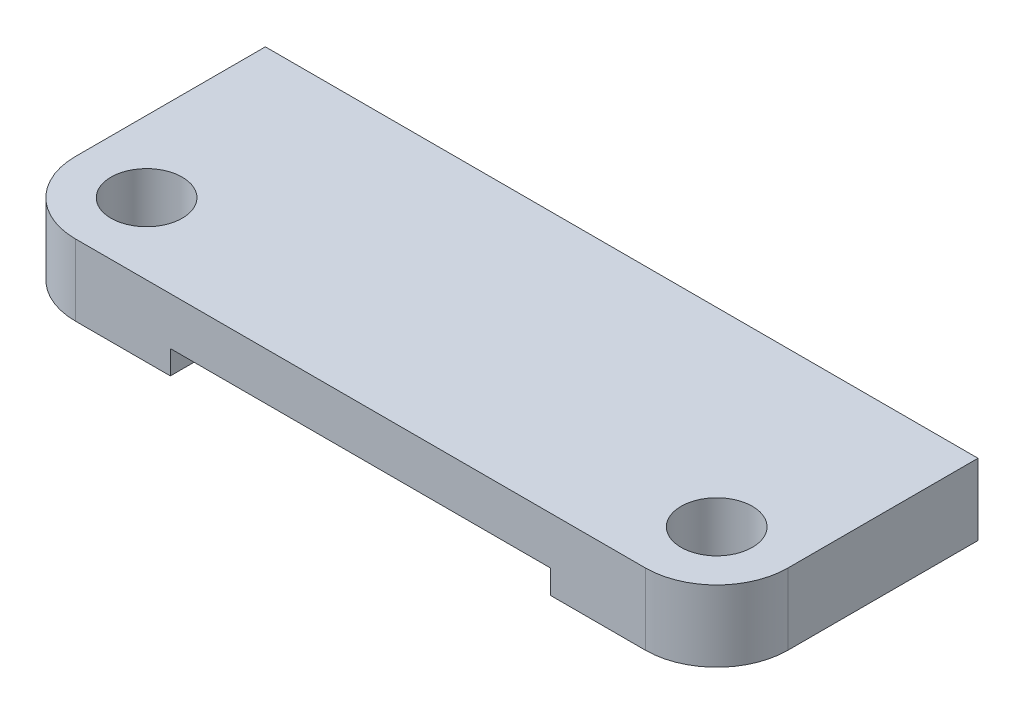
SolidWorks part; units mm, degrees
ref_plane "前视基准面" through (0, 0, 0) normal (0, 0, 1) x (1, 0, 0)
ref_plane "上视基准面" through (0, 0, 0) normal (0, 1, 0) x (1, 0, 0)
ref_plane "右视基准面" through (0, 0, 0) normal (1, 0, 0) x (0, 0, -1)
sketch "草图1" plane through (0, 0, 0) normal (0, 1, 0) x (1, 0, 0)
  line L0 (30, 0) -> (-30, 0)
  line L1 (-30, 0) -> (-30, -16)
  line L2 (-24, -22) -> (24, -22)
  line L3 (0, 24.4123) -> (0, -40.1298) construction
  line L4 (-24, -8.8168) -> (-24, -27.5731) construction
  line L5 (-35.1279, -16) -> (-17.5773, -16) construction
  line L6 (30, 0) -> (30, -16)
  circle A0 centre (-24, -16) radius 3
  arc A1 (-30, -16) -> (-24, -22) centre (-24, -16) ccw
  circle A2 centre (24, -16) radius 3
  arc A3 (30, -16) -> (24, -22) centre (24, -16) cw
  point P15 (-30, -22)
  point P20 (0, -22)
  point P21 (0, 0)
  dimension "D3" = 6
  dimension "D4" = 6
  dimension "D1" = 30
  dimension "D2" = 22
extrude "凸台-拉伸1" add sketch "草图1" along normal blind 6
sketch "草图2" plane through (0, 0, 22) normal (0, 0, 1) x (1, 0, 0)
  line L0 (16, 0) -> (-16, 0)
  line L1 (-24, 0) -> (24, 0) construction
  line L2 (-16, 0) -> (-16, 2)
  line L3 (-16, 2) -> (16, 2)
  line L4 (0, -3.784) -> (0, 11.3172) construction
  line L5 (16, 0) -> (16, 2)
  point P7 (0, 0)
  point P11 (0, 2)
  dimension "D1" = 16
  dimension "D2" = 2
extrude "切除-拉伸1" cut sketch "草图2" against normal through all
